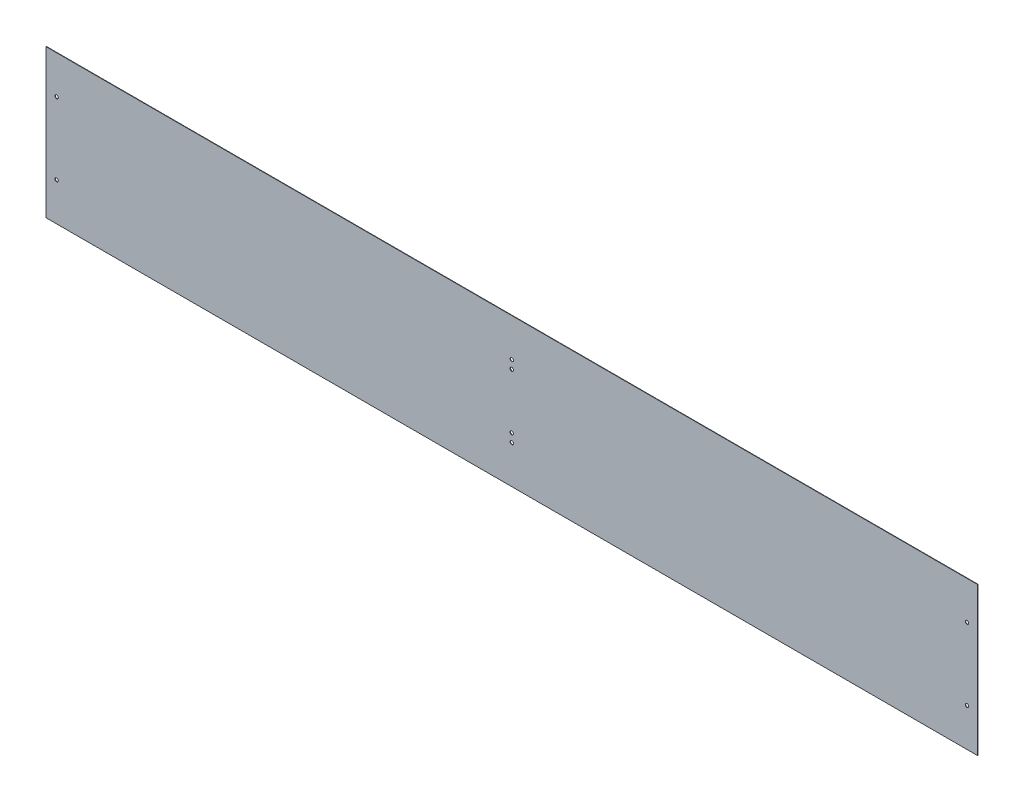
SolidWorks part; units mm, degrees
ref_plane "Front Plane" through (0, 0, 0) normal (0, 0, 1) x (1, 0, 0)
ref_plane "Top Plane" through (0, 0, 0) normal (0, 1, 0) x (1, 0, 0)
ref_plane "Right Plane" through (0, 0, 0) normal (1, 0, 0) x (0, 0, -1)
sketch "Sketch1" plane through (0, 0, 0) normal (0, 1, 0) x (1, 0, 0)
  line L0 (0, 0) -> (0, 0.1) construction
  line L1 (0, 0.1) -> (-220, 0.1) construction
  line L3 (-220, 0.1) -> (220, 0.1)
  line L4 (-220, 0.1) -> (-220, -0.1)
  line L5 (-220, -0.1) -> (220, -0.1)
  line L6 (220, 0.1) -> (220, -0.1)
  point P1 (0, 0)
  point P8 (0, 0.1)
  point P9 (-220, 0)
  dimension "D2" = 0.2
  dimension "D3" = 440
extrude "Boss-Extrude1" add sketch "Sketch1" along normal blind 70
sketch "Sketch2" plane through (0, 0, -0.1) normal (0, 0, -1) x (-1, 0, 0)
  line L0 (-215, 70) -> (-215, 0) construction
  line L1 (-220, 70) -> (220, 70) construction
  line L2 (-220, 0) -> (220, 0) construction
  line L3 (215, 70) -> (215, 0) construction
  line L4 (0, 0) -> (0, 70) construction
  line L5 (-220, 70) -> (-220, 0) construction
  line L6 (220, 70) -> (220, 0) construction
  circle A0 centre (-215, 18) radius 0.8
  circle A1 centre (-215, 52) radius 0.8
  circle A2 centre (0, 52) radius 0.8
  circle A3 centre (0, 22) radius 0.8
  circle A4 centre (0, 18) radius 0.8
  circle A5 centre (0, 48) radius 0.8
  circle A6 centre (215, 18) radius 0.8
  circle A7 centre (215, 52) radius 0.8
  point P27 (-215, 35)
  point P28 (0, 35)
  dimension "D3" = 1.6
  dimension "D4" = 1.6
  dimension "D5" = 1.6
  dimension "D6" = 1.6
  dimension "D7" = 1.6
  dimension "D8" = 1.6
  dimension "D1" = 5
  dimension "D2" = 5
  dimension "D9" = 34
  dimension "D10" = 17
  dimension "D11" = 4
  dimension "D12" = 26
  dimension "D13" = 4
  dimension "D14" = 70
  dimension "D15" = 13
extrude "Cut-Extrude1" cut sketch "Sketch2" against normal through all
